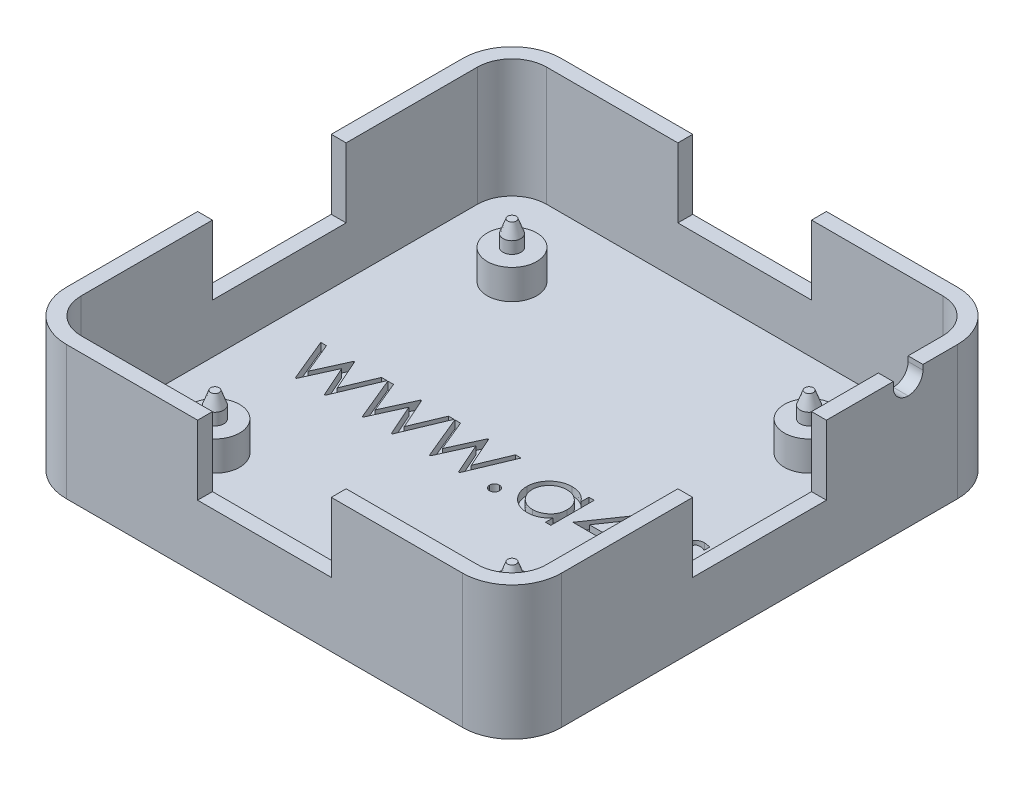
SolidWorks part; units mm, degrees
ref_plane "Plan de face" through (0, 0, 0) normal (0, 0, 1) x (1, 0, 0)
ref_plane "Plan de dessus" through (0, 0, 0) normal (0, 1, 0) x (1, 0, 0)
ref_plane "Plan de droite" through (0, 0, 0) normal (1, 0, 0) x (0, 0, -1)
sketch "Esquisse1" plane through (0, 0, 0) normal (0, 1, 0) x (1, 0, 0)
  line L1 (-155.1718, -2.6693) -> (-115.1718, -2.6693)
  line L2 (-160.1718, -7.6693) -> (-160.1718, -47.6693)
  line L3 (-155.1718, -52.6693) -> (-115.1718, -52.6693)
  line L4 (-110.1718, -7.6693) -> (-110.1718, -47.6693)
  line L5 (-160.1718, -2.6693) -> (-110.1718, -52.6693) construction
  line L6 (-160.1718, -52.6693) -> (-110.1718, -2.6693) construction
  arc A0 (-160.1718, -47.6693) -> (-155.1718, -52.6693) centre (-155.1718, -47.6693) ccw
  arc A1 (-115.1718, -52.6693) -> (-110.1718, -47.6693) centre (-115.1718, -47.6693) ccw
  arc A2 (-115.1718, -2.6693) -> (-110.1718, -7.6693) centre (-115.1718, -7.6693) cw
  arc A3 (-155.1718, -2.6693) -> (-160.1718, -7.6693) centre (-155.1718, -7.6693) ccw
  point P0 (-135.1718, -27.6693)
  dimension "D3" = 5
  dimension "D1" = 50
  dimension "D2" = 50
extrude "Boss.-Extru.1" add sketch "Esquisse1" along normal blind 13.5
shell "Coque1" thickness 1.5
sketch "Esquisse2" plane through (0, 1.5, 0) normal (0, 1, 0) x (1, 0, 0)
  line L0 (-135.1718, -4.1693) -> (-135.1718, -53.8889) construction
  line L1 (-115.1718, -4.1693) -> (-155.1718, -4.1693) construction
  line L2 (-158.6718, -27.6693) -> (-103.4325, -27.6693) construction
  line L3 (-158.6718, -7.6693) -> (-158.6718, -47.6693) construction
  circle A0 centre (-150.1718, -12.6693) radius 2.5
  circle A1 centre (-120.1718, -12.6693) radius 2.5
  circle A2 centre (-150.1718, -42.6693) radius 2.5
  circle A3 centre (-120.1718, -42.6693) radius 2.5
  dimension "D1" = 15
  dimension "D2" = 15
extrude "Boss.-Extru.2" add sketch "Esquisse2" along normal blind 3
sketch "Esquisse3" plane through (0, 4.5, 0) normal (0, 1, 0) x (1, 0, 0)
  line L0 (-135.1718, -4.1693) -> (-135.1718, -39.8098) construction
  line L1 (-115.1718, -4.1693) -> (-155.1718, -4.1693) construction
  line L2 (-158.6718, -27.6693) -> (-123.9254, -27.6693) construction
  line L3 (-158.6718, -7.6693) -> (-158.6718, -47.6693) construction
  circle A0 centre (-150.1718, -12.6693) radius 0.9
  circle A1 centre (-120.1718, -12.6693) radius 0.9
  circle A2 centre (-120.1718, -42.6693) radius 0.9
  circle A3 centre (-150.1718, -42.6693) radius 0.9
extrude "Boss.-Extru.3" add sketch "Esquisse3" along normal blind 2.5
chamfer "Chanfrein1" distance 1.3 angle 20 4 edges at (-120.1718, 7, 43.5693) (-150.1718, 7, 41.7693) (-120.1718, 7, 11.7693) (-150.1718, 7, 13.5693)
sketch "Esquisse4" plane through (0, 13.5, 0) normal (0, 1, 0) x (1, 0, 0)
  line L0 (-158.6718, -27.6693) -> (-97.1234, -27.6693) construction
  line L1 (-158.6718, -7.6693) -> (-158.6718, -47.6693) construction
  line L2 (-115.1718, -4.1693) -> (-155.1718, -4.1693) construction
  line L4 (-141.9218, 0.4569) -> (-128.4218, 0.4569)
  line L5 (-113.4561, -20.9193) -> (-106.8326, -20.9193)
  line L6 (-113.4561, -20.9193) -> (-113.4561, -34.4193)
  line L7 (-113.4561, -34.4193) -> (-106.8326, -34.4193)
  line L8 (-106.8326, -20.9193) -> (-106.8326, -34.4193)
  line L9 (-113.4561, -20.9193) -> (-106.8326, -34.4193) construction
  line L10 (-113.4561, -34.4193) -> (-106.8326, -20.9193) construction
  line L11 (-141.9218, 0.4569) -> (-141.9218, -8.7956)
  line L12 (-141.9218, -8.7956) -> (-128.4218, -8.7956)
  line L13 (-128.4218, 0.4569) -> (-128.4218, -8.7956)
  line L14 (-135.1718, -27.6693) -> (-115.8574, -8.7956) construction
  line L15 (-141.9218, 0.4569) -> (-128.4218, -8.7956) construction
  line L16 (-141.9218, -8.7956) -> (-128.4218, 0.4569) construction
  line L17 (-155.1718, -51.1693) -> (-115.1718, -51.1693) construction
  line L18 (-163.0334, -20.9193) -> (-154.3102, -20.9193)
  line L19 (-163.0334, -20.9193) -> (-163.0334, -34.4193)
  line L20 (-163.0334, -34.4193) -> (-154.3102, -34.4193)
  line L21 (-154.3102, -20.9193) -> (-154.3102, -34.4193)
  line L22 (-163.0334, -20.9193) -> (-154.3102, -34.4193) construction
  line L23 (-163.0334, -34.4193) -> (-154.3102, -20.9193) construction
  line L24 (-141.9218, -46.3648) -> (-128.4218, -46.3648)
  line L25 (-141.9218, -46.3648) -> (-141.9218, -55.9739)
  line L26 (-141.9218, -55.9739) -> (-128.4218, -55.9739)
  line L27 (-128.4218, -46.3648) -> (-128.4218, -55.9739)
  line L28 (-141.9218, -46.3648) -> (-128.4218, -55.9739) construction
  line L29 (-141.9218, -55.9739) -> (-128.4218, -46.3648) construction
  point P4 (-135.1718, -4.1693)
  point P8 (-110.1444, -27.6693)
  point P22 (-135.1718, -51.1693)
  point P34 (-133.6718, -27.1693)
  dimension "D1" = 13.5
  dimension "D2" = 13.5
  dimension "D3" = 13.5
  dimension "D4" = 13.5
extrude "Enlèv. mat.-Extru.1" cut sketch "Esquisse4" against normal blind 7
sketch "Esquisse5" plane through (0, 13.5, 0) normal (0, 1, 0) x (1, 0, 0)
  line L0 (-120.1718, -12.6693) -> (-102.7188, -12.6693) construction
  line L2 (-115.4235, -11.1693) -> (-108.0241, -11.1693)
  line L3 (-115.4235, -11.1693) -> (-115.4235, -14.1693)
  line L4 (-115.4235, -14.1693) -> (-108.0241, -14.1693)
  line L5 (-108.0241, -11.1693) -> (-108.0241, -14.1693)
  line L6 (-115.4235, -11.1693) -> (-108.0241, -14.1693) construction
  line L7 (-115.4235, -14.1693) -> (-108.0241, -11.1693) construction
  point P2 (-111.7238, -12.6693)
  dimension "D1" = 3
extrude "Enlèv. mat.-Extru.2" cut sketch "Esquisse5" against normal blind 2
fillet "Congé1" radius 1.5 2 edges at (-110.9218, 11.5, 14.1693) (-110.9218, 11.5, 11.1693)
sketch "Esquisse6" plane through (0, 1.5, 0) normal (0, 1, 0) x (1, 0, 0)
  text T0 "www.a4.fr" font "Century Gothic" height 6
extrude "Enlèv. mat.-Extru.3" cut sketch "Esquisse6" against normal blind 0.8
